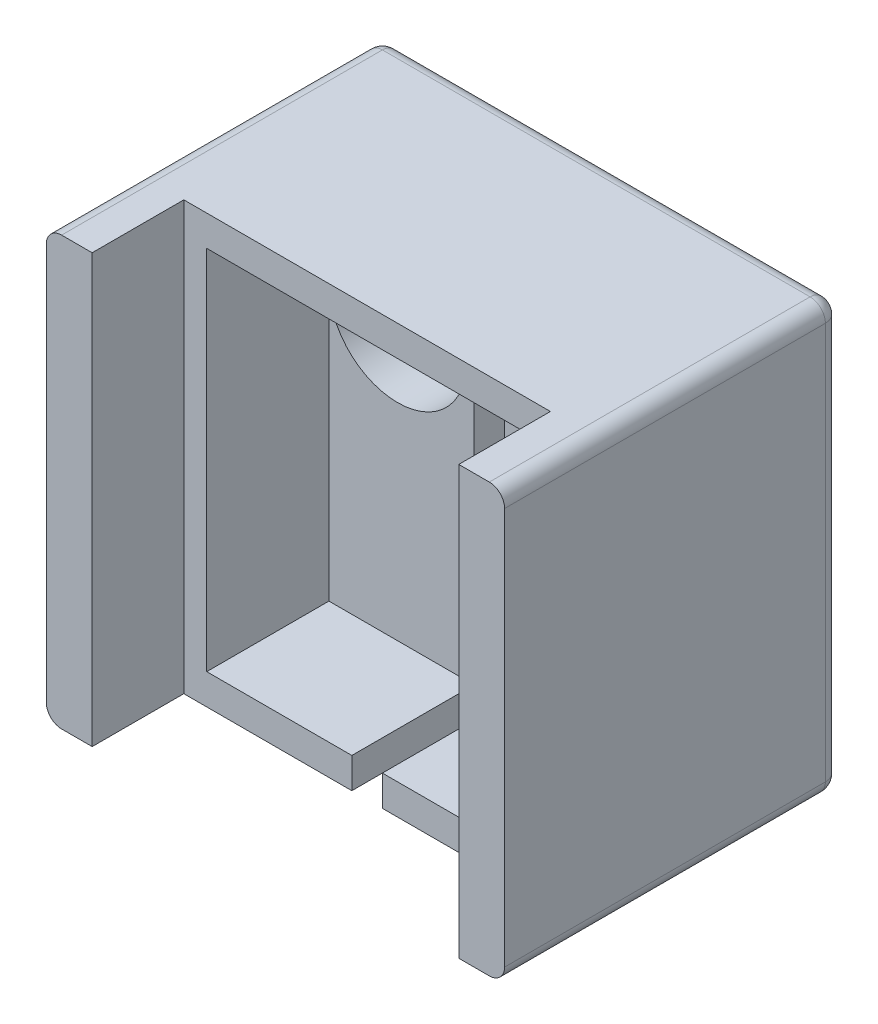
SolidWorks part; units mm, degrees
ref_plane "Plan1" through (0, 0, 0) normal (0, 0, 1) x (1, 0, 0)
ref_plane "Plan2" through (0, 0, 0) normal (0, 1, 0) x (1, 0, 0)
ref_plane "Plan3" through (0, 0, 0) normal (1, 0, 0) x (0, 0, -1)
sketch "Esquisse1" plane through (0, 0, 0) normal (0, 0, 1) x (1, 0, 0)
  line L1 (0, 0) -> (15, 0)
  line L2 (0, 0) -> (0, 14)
  line L3 (0, 14) -> (15, 14)
  line L4 (15, 0) -> (15, 14)
  dimension "D1" = 14
  dimension "D2" = 15
extrude "Base-Extrusion" add sketch "Esquisse1" along normal blind 11
sketch "Esquisse2" plane through (0, 0, 11) normal (0, 0, 1) x (1, 0, 0)
  line L0 (15, 14) -> (0, 14) construction
  line L1 (1.5, 14) -> (13.5, 14)
  line L2 (1.5, 14) -> (1.5, 0)
  line L3 (1.5, 0) -> (13.5, 0)
  line L4 (13.5, 14) -> (13.5, 0)
  line L5 (15, 0) -> (15, 14) construction
  line L7 (0, 0) -> (15, 0) construction
  line L8 (13.5, 7) -> (15, 7) construction
  line L9 (1.5, 7) -> (0, 7) construction
  line L10 (0, 14) -> (0, 0) construction
  point P6 (15, 7)
  dimension "D1" = 12
extrude "Enlèv. mat.-Extru.1" cut sketch "Esquisse2" against normal blind 3
sketch "Esquisse4" plane through (0, 0, 8) normal (0, 0, 1) x (1, 0, 0)
  line L0 (12.75, 7) -> (13.5, 7) construction
  line L1 (2.25, 13) -> (12.75, 13)
  line L2 (2.25, 13) -> (2.25, 1)
  line L3 (2.25, 1) -> (12.75, 1)
  line L4 (12.75, 13) -> (12.75, 1)
  line L5 (13.5, 0) -> (13.5, 14) construction
  line L6 (2.25, 7) -> (1.5, 7) construction
  line L7 (1.5, 14) -> (1.5, 0) construction
  line L8 (7.5, 13) -> (7.5, 14) construction
  line L9 (13.5, 14) -> (1.5, 14) construction
  line L10 (7.5, 1) -> (7.5, 0) construction
  line L11 (1.5, 0) -> (13.5, 0) construction
  dimension "D1" = 10.5
  dimension "D2" = 12
extrude "Enlèv. mat.-Extru.3" cut sketch "Esquisse4" against normal blind 4
sketch "Esquisse3" plane through (0, 0, 0) normal (0, -1, 0) x (1, 0, 0)
  line L0 (7.5, 8) -> (7.5, 0) construction
  line L1 (0, 0) -> (15, 0) construction
  line L2 (1.5, 8) -> (13.5, 8) construction
  line L4 (8, 8) -> (7, 8)
  line L5 (8, 8) -> (8, 3)
  line L6 (8, 3) -> (7, 3)
  line L7 (7, 8) -> (7, 3)
  dimension "D1" = 1
  dimension "D2" = 5
extrude "Enlèv. mat.-Extru.4" cut sketch "Esquisse3" against normal up to surface (13 mm away)
other "Perçage1"
sketch "Esquisse5" plane through (0, 0, 4) normal (0, 0, 1) x (1, 0, 0)
  line L0 (8, 0) -> (13.5, 0) construction
  line L1 (13.5, 0) -> (13.5, 14) construction
  circle A0 centre (10.5, 5) radius 2.25
  dimension "D1" = 4.5
  dimension "D2" = 5
  dimension "D3" = 3
other "Perçage2"
sketch "Esquisse6" plane through (0, 0, 4) normal (0, 0, 1) x (1, 0, 0)
  line L0 (1.5, 0) -> (7, 0) construction
  line L1 (1.5, 14) -> (1.5, 0) construction
  circle A0 centre (4.5, 10) radius 2.25
  dimension "D1" = 4.5
  dimension "D2" = 10
  dimension "D3" = 3
fillet "Congé1" radius 0.5
